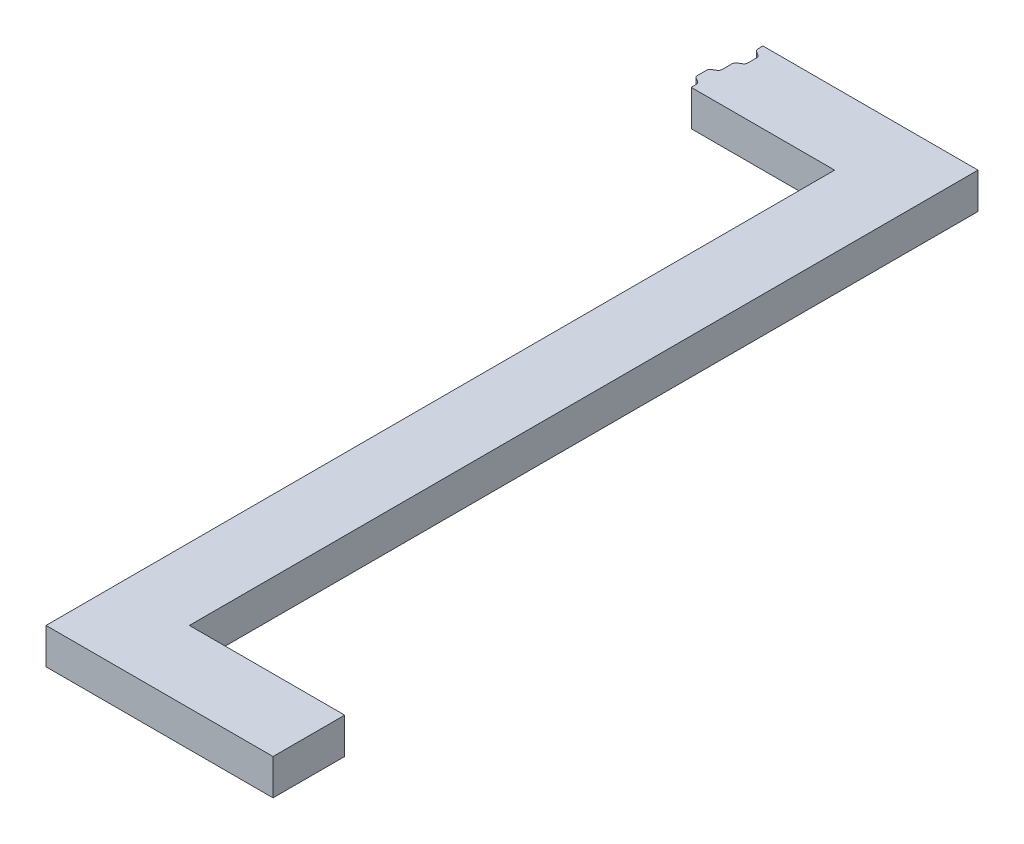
SolidWorks part; units mm, degrees
ref_plane "Face" through (0, 0, 0) normal (0, 0, 1) x (1, 0, 0)
ref_plane "Dessus" through (0, 0, 0) normal (0, 1, 0) x (1, 0, 0)
ref_plane "Droite" through (0, 0, 0) normal (1, 0, 0) x (0, 0, -1)
sketch "Esquisse1" plane through (0, 0, 0) normal (0, 1, 0) x (1, 0, 0)
  line L0 (90, 30) -> (90, -300)
  line L1 (0, -19.1048) -> (0, 70.5732) construction
  line L2 (90, -300) -> (155, -300)
  line L3 (155, -300) -> (155, -330)
  line L4 (155, -330) -> (60, -330)
  line L5 (60, -330) -> (60, 0)
  line L19 (0.2, 30) -> (90, 30)
  line L20 (0.2, 0) -> (60, 0)
  line L21 (1.5, -19.1048) -> (1.5, 42.3436) construction
  line L27 (3, 32.4084) -> (3, -19.1048) construction
  line L32 (0, 29.8) -> (0, 27.9238)
  line L33 (0.8, 26.5381) -> (2.2, 25.7298)
  line L34 (3, 24.3442) -> (3, 20.6604)
  line L35 (2.2022, 19.276) -> (0.7978, 18.4623)
  line L36 (0, 17.0779) -> (0, 12.9221)
  line L37 (0, 0.2) -> (0, 2.0762)
  line L38 (-0.8, 3.4619) -> (-2.2, 4.2702)
  line L39 (-3, 5.6558) -> (-3, 9.3396)
  line L40 (-2.2022, 10.724) -> (-0.7978, 11.5377)
  arc A5 (0, 29.8) -> (0.2, 30) centre (0.2, 29.8) cw
  arc A9 (0, 0.2) -> (0.2, 0) centre (0.2, 0.2) ccw
  arc A16 (0, 27.9238) -> (0.8, 26.5381) centre (1.6, 27.9238) ccw
  arc A17 (2.2, 25.7298) -> (3, 24.3442) centre (1.4, 24.3442) cw
  arc A18 (3, 20.6604) -> (2.2022, 19.276) centre (1.4, 20.6604) cw
  arc A19 (-0.7978, 11.5377) -> (0, 12.9221) centre (-1.6, 12.9221) ccw
  arc A20 (0.7978, 18.4623) -> (0, 17.0779) centre (1.6, 17.0779) ccw
  arc A21 (0, 2.0762) -> (-0.8, 3.4619) centre (-1.6, 2.0762) ccw
  arc A22 (-2.2, 4.2702) -> (-3, 5.6558) centre (-1.4, 5.6558) cw
  arc A23 (-3, 9.3396) -> (-2.2022, 10.724) centre (-1.4, 9.3396) cw
  point P123 (0, 30)
  point P139 (0, 0)
  dimension "D7" = 360
  dimension "D6" = 30
  dimension "D23" = 0.2
  dimension "D3" = 93
  dimension "D4" = 63
  dimension "D5" = 30
  dimension "D8" = 95
  dimension "D15" = 1.5
extrude "Extrusion1" add sketch "Esquisse1" along normal blind 15
